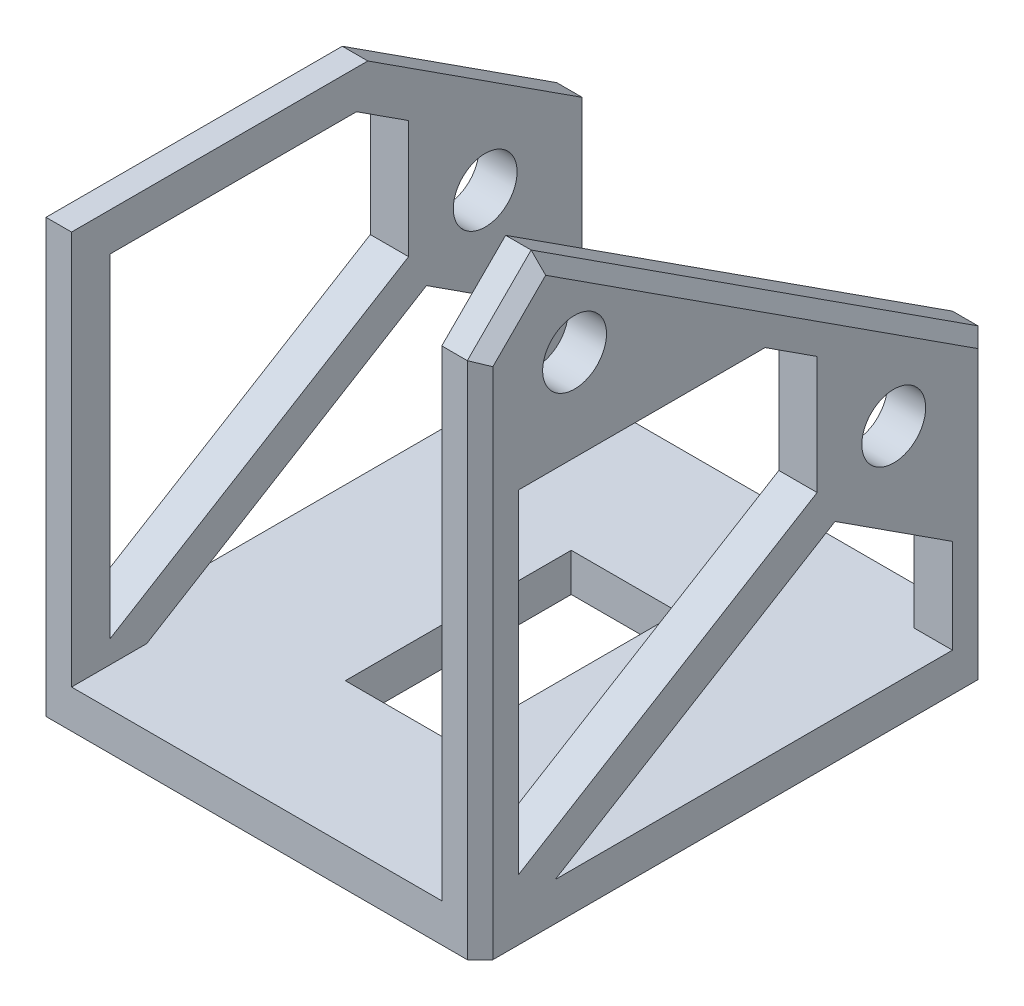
SolidWorks part; units mm, degrees
ref_plane "Alzado" through (0, 0, 0) normal (0, 0, 1) x (1, 0, 0)
ref_plane "Planta" through (0, 0, 0) normal (0, 1, 0) x (1, 0, 0)
ref_plane "Vista lateral" through (0, 0, 0) normal (1, 0, 0) x (0, 0, -1)
sketch "Croquis1" plane through (0, 0, 0) normal (0, 1, 0) x (1, 0, 0)
  line L1 (-17.5, 20) -> (17.5, 20)
  line L2 (-17.5, 20) -> (-17.5, -20)
  line L3 (-17.5, -20) -> (17.5, -20)
  line L4 (17.5, 20) -> (17.5, -20)
  line L5 (-17.5, 20) -> (17.5, -20) construction
  line L6 (-17.5, -20) -> (17.5, 20) construction
  line L9 (0, 0) -> (0, 50000) construction
  line L10 (0, 0) -> (50000, 0) construction
  line L17 (-4.2068, 8.8476) -> (4.2068, 8.8476)
  line L18 (-4.2068, 8.8476) -> (-4.2068, -8.8476)
  line L19 (-4.2068, -8.8476) -> (4.2068, -8.8476)
  line L20 (4.2068, 8.8476) -> (4.2068, -8.8476)
  line L21 (-4.2068, 8.8476) -> (4.2068, -8.8476) construction
  line L22 (-4.2068, -8.8476) -> (4.2068, 8.8476) construction
  point P0 (0, 0)
  point P18 (0, 0)
  dimension "D1" = 35
  dimension "D2" = 40
extrude "Saliente-Extruir2" add sketch "Croquis1" along normal mid plane 3 contours L2 L3 L4 L1
sketch "Croquis2" plane through (17.5, 0, 0) normal (1, 0, 0) x (0, 0, -1)
  line L0 (-20, 1.5) -> (-20, 39.1413)
  line L1 (-20, 39.1413) -> (-15, 44.1413)
  line L2 (-15, 44.1413) -> (20, 21.5)
  line L3 (20, 21.5) -> (20, 1.5)
  line L4 (-20, 1.5) -> (20, 1.5)
  line L5 (12.4007, 19) -> (20, 21.5) construction
  line L6 (-12.5993, 36.51) -> (-15, 44.1413) construction
  circle A0 centre (12.4007, 19) radius 2.5
  circle A1 centre (-12.5993, 36.51) radius 2.5
  dimension "D3" = 5
  dimension "D1" = 45
  dimension "D2" = 5
  dimension "D4" = 20
  dimension "D5" = 17.51
  dimension "D6" = 8
  dimension "D7" = 2.5
  dimension "D8" = 25
extrude "Saliente-Extruir3" add sketch "Croquis2" against normal blind 3
sketch "Croquis3" plane through (-17.5, 0, 0) normal (-1, 0, 0) x (0, 0, 1)
  line L0 (-20, 1.5) -> (-20, 21.5)
  line L1 (-20, 21.5) -> (-3.2073, 32.3631)
  line L2 (-20, 21.5) -> (15, 44.1413) construction
  line L3 (-3.2073, 32.3631) -> (20, 32.3631)
  line L4 (20, 39.1413) -> (20, 1.5) construction
  line L5 (20, 32.3631) -> (20, 1.5)
  line L6 (20, 1.5) -> (-20, 1.5)
  circle A0 centre (-12.4007, 19) radius 2.5 construction
  circle A1 centre (-12.4007, 19) radius 2.5
extrude "Saliente-Extruir4" add sketch "Croquis3" against normal blind 3
chamfer "Chaflán2" distance 1 angle 45 8 edges at (-17.5, 10, -20) (-17.5, 26.9315, -11.6037) (-17.5, 32.3631, 8.3963) (-17.5, 15.4315, 20) (17.5, 10, -20) (17.5, 18.8207, 20) (17.5, 41.6413, 17.5) (17.5, 32.8207, -2.5)
sketch "Croquis4" plane through (17.5, 0, 0) normal (1, 0, 0) x (0, 0, -1)
  line L0 (-17, 1.5) -> (17, 1.5) construction
  line L1 (17, 1.5) -> (17, 8.8787)
  line L2 (17, 8.8787) -> (6.4007, 15.7354) construction
  line L3 (6.4007, 15.7354) -> (6.4007, 26.7244) construction
  line L4 (6.4007, 26.7244) -> (2.3216, 29.3631)
  line L5 (2.3216, 29.3631) -> (-17, 29.3631)
  line L6 (-17, 29.3631) -> (-17, 1.5) construction
  line L7 (-15, 44.1413) -> (20, 21.5) construction
  line L8 (-20, -1.5) -> (-20, 39.1413) construction
  line L9 (-19, -1.5) -> (19, -1.5) construction
  line L10 (20, 21.5) -> (20, -1.5) construction
  line L11 (-20, 32.3631) -> (3.2073, 32.3631) construction
  line L12 (-20, 32.3631) -> (3.2073, 32.3631) construction
  line L13 (-17, 29.3631) -> (-17, 3.2557)
  line L14 (-17, 3.2557) -> (6.4007, 17.4911)
  line L15 (6.4007, 17.4911) -> (6.4007, 26.7244)
  line L16 (17, 8.8787) -> (7.7994, 14.8305)
  line L17 (7.7994, 14.8305) -> (-14.1138, 1.5)
  line L18 (-14.1138, 1.5) -> (17, 1.5)
  line L19 (-17, 1.5) -> (6.4007, 15.7354) construction
  circle A1 centre (12.4007, 19) radius 2.5 construction
  dimension "D5" = 3
  dimension "D7" = 6
  dimension "D1" = 3
  dimension "D2" = 3
  dimension "D3" = 3
  dimension "D4" = 3
  dimension "D6" = 6
  dimension "D8" = 3
  dimension "D9" = 1.5
extrude "Cortar-Extruir1" cut sketch "Croquis4" against normal through all
